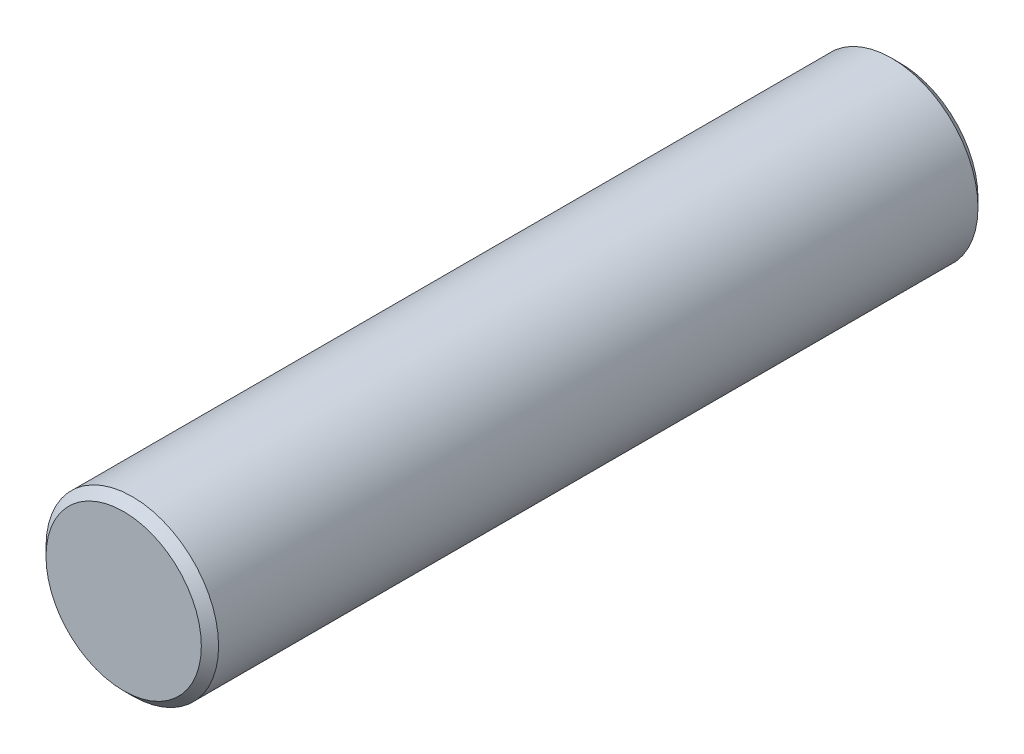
SolidWorks part; units mm, degrees
ref_plane "Alzado" through (0, 0, 0) normal (0, 0, 1) x (1, 0, 0)
ref_plane "Planta" through (0, 0, 0) normal (0, 1, 0) x (1, 0, 0)
ref_plane "Vista lateral" through (0, 0, 0) normal (1, 0, 0) x (0, 0, -1)
sketch "Croquis1" plane through (0, 0, 0) normal (0, 0, 1) x (1, 0, 0)
  circle A0 centre (0, 0) radius 5
  dimension "D1" = 10
extrude "Extruir1" add sketch "Croquis1" along normal blind 45
chamfer "Chaflán1" distance 0.5 angle 45 2 edges at (5, 0, 45) (5, 0, 0)
